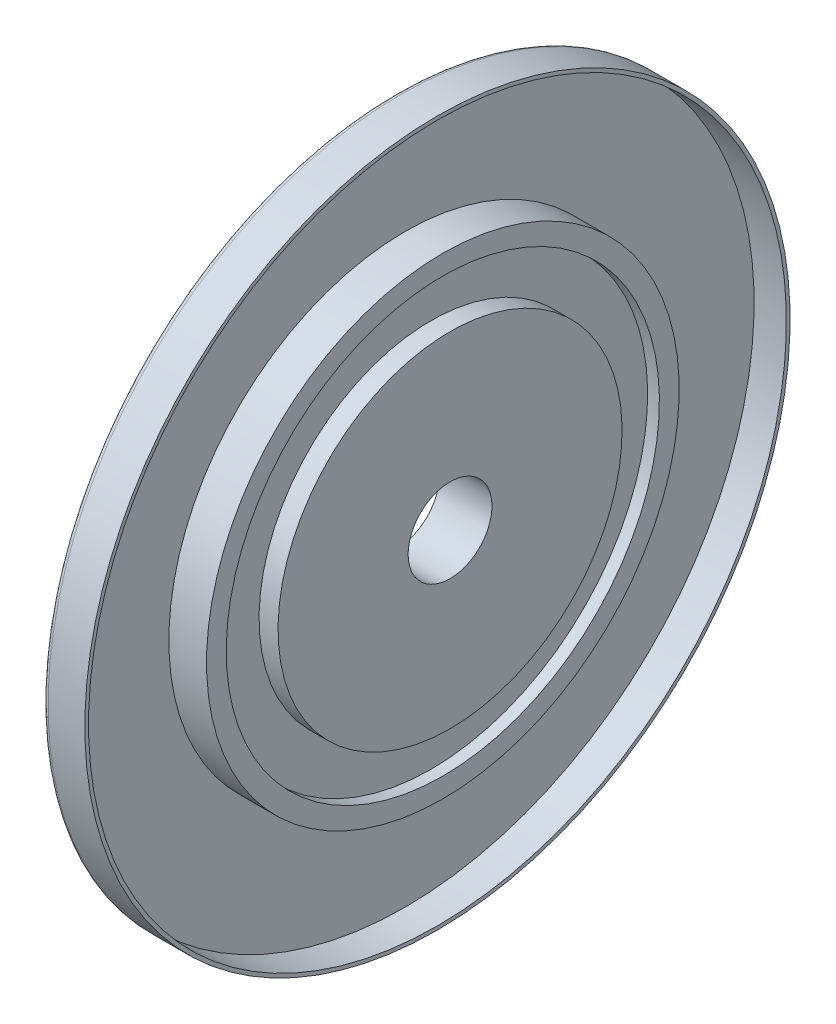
SolidWorks part; units mm, degrees
ref_plane "Front" through (0, 0, 0) normal (0, 0, 1) x (1, 0, 0)
ref_plane "Top" through (0, 0, 0) normal (0, 1, 0) x (1, 0, 0)
ref_plane "Right" through (0, 0, 0) normal (1, 0, 0) x (0, 0, -1)
sketch "Sketch2" plane through (0, 0, 0) normal (0, 0, 1) x (1, 0, 0)
  line L0 (-4.1656, 26.67) -> (-5.9944, 26.67)
  line L1 (-11.5, 18.8277) -> (-11.5, 53.8749)
  line L2 (-4.1656, 36.6395) -> (-10.0076, 36.6395)
  line L3 (-5, 54.6687) -> (-10.7062, 54.6687)
  line L4 (-5.9944, 26.67) -> (-5.9944, 33.5788)
  line L5 (-5, 54.102) -> (-5, 54.6687)
  line L6 (-5.9944, 33.5788) -> (-4.1656, 33.5788)
  line L7 (-4.699, 12.7) -> (-7.0676, 12.7)
  line L8 (-7.0676, 12.5) -> (-7.0675, -12.5) construction
  line L9 (-7.0676, 12.7) -> (-11.2061, 6.5)
  line L10 (-11.2061, 6.35) -> (-11.2061, -6.35) construction
  line L11 (-11.2061, 6.5) -> (-4.699, 6.5)
  line L14 (0, 0) -> (78.034, 0) construction
  line L19 (-4.699, 12.7) -> (-4.699, 18.034)
  line L20 (-4.699, 18.034) -> (-10.7062, 18.034)
  line L32 (-10.0076, 54.102) -> (-10.0076, 36.6395)
  line L35 (-4.1656, 36.6395) -> (-4.1656, 33.5788)
  line L41 (-3.048, 26.67) -> (-4.1656, 26.67)
  line L43 (-3.048, 26.67) -> (-3.048, 6.5)
  line L45 (-3.048, 6.5) -> (-4.699, 6.5)
  line L55 (-5, 54.102) -> (-10.0076, 54.102)
  arc A1 (-11.5, 53.8749) -> (-10.7062, 54.6687) centre (-10.7062, 53.8749) cw
  arc A3 (-11.5, 18.8277) -> (-10.7062, 18.034) centre (-10.7062, 18.8277) ccw
  dimension "D6" = 54.102
  dimension "D15" = 0.7937
  dimension "D16" = 0.7937
  dimension "D1" = 6.5
  dimension "D2" = 18.034
  dimension "D3" = 26.67
  dimension "D4" = 33.5788
  dimension "D5" = 36.6395
  dimension "D7" = 54.6687
  dimension "D8" = 3.048
  dimension "D9" = 4.699
  dimension "D10" = 11.5
  dimension "D11" = 5.9944
  dimension "D12" = 4.1656
  dimension "D13" = 10.0076
  dimension "D14" = 5
  dimension "D17" = 12.7
revolve "Revolve1" add sketch "Sketch2" angle 360 about L14
